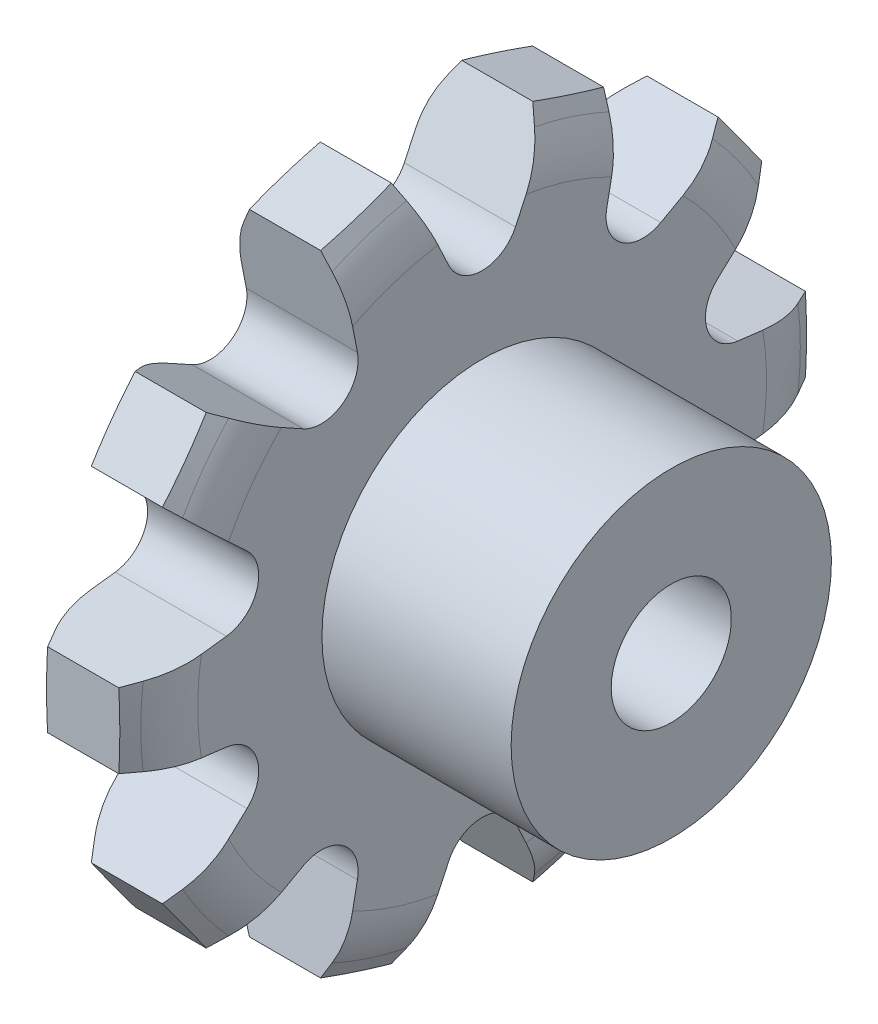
SolidWorks part; units mm, degrees
ref_plane "Plan de face" through (0, 0, 0) normal (0, 0, 1) x (1, 0, 0)
ref_plane "Plan de dessus" through (0, 0, 0) normal (0, 1, 0) x (1, 0, 0)
ref_plane "Plan de droite" through (0, 0, 0) normal (1, 0, 0) x (0, 0, -1)
sketch "Esquisse1" plane through (0, 0, 0) normal (0, 0, 1) x (1, 0, 0)
  line L0 (0, 28.4053) -> (0, 6)
  line L1 (0, 6) -> (30, 6)
  line L2 (30, 6) -> (30, 16)
  line L4 (11.1, 16) -> (11.1, 28.4053)
  line L5 (9.9469, 32.9416) -> (9.1, 34.5)
  line L6 (9.1, 34.5) -> (2, 34.5)
  line L7 (2, 34.5) -> (1.1531, 32.9416)
  line L8 (30, 0) -> (0, 0) construction
  line L10 (11.1, 16) -> (30, 16)
  arc A0 (11.1, 28.4053) -> (9.9469, 32.9416) centre (1.6, 28.4053) ccw
  arc A1 (1.1531, 32.9416) -> (0, 28.4053) centre (9.5, 28.4053) ccw
revolve "Révolution1" add sketch "Esquisse1" angle 360 about L8
ref_plane "Plan1" through (5.55, 0, 0) normal (1, 0, 0) x (0, 0, -1)
sketch "Esquisse2" plane through (5.55, 0, 0) normal (1, 0, 0) x (0, 0, -1)
  line L0 (-34.299, 3.7184) -> (-34.299, -3.7184)
  line L1 (-34.299, -3.7184) -> (-25.5451, -4.7932)
  line L2 (-23.4838, -11.1372) -> (-29.9341, -17.1522)
  line L3 (-29.9341, -17.1522) -> (-25.5629, -23.1687)
  line L4 (-25.5629, -23.1687) -> (-17.849, -18.8928)
  line L5 (-12.4525, -22.8136) -> (-14.1354, -31.4713)
  line L6 (-14.1354, -31.4713) -> (-7.0626, -33.7694)
  line L7 (-7.0626, -33.7694) -> (-3.3352, -25.776)
  line L8 (3.3352, -25.776) -> (7.0626, -33.7694)
  line L9 (7.0626, -33.7694) -> (14.1354, -31.4713)
  line L10 (14.1354, -31.4713) -> (12.4525, -22.8136)
  line L11 (17.849, -18.8928) -> (25.5629, -23.1687)
  line L12 (25.5629, -23.1687) -> (29.9341, -17.1522)
  line L13 (29.9341, -17.1522) -> (23.4838, -11.1372)
  line L14 (25.5451, -4.7932) -> (34.299, -3.7184)
  line L15 (34.299, -3.7184) -> (34.299, 3.7184)
  line L16 (34.299, 3.7184) -> (25.5451, 4.7932)
  line L17 (23.4838, 11.1372) -> (29.9341, 17.1522)
  line L18 (29.9341, 17.1522) -> (25.5629, 23.1687)
  line L19 (25.5629, 23.1687) -> (17.849, 18.8928)
  line L20 (12.4525, 22.8136) -> (14.1354, 31.4713)
  line L21 (14.1354, 31.4713) -> (7.0626, 33.7694)
  line L22 (7.0626, 33.7694) -> (3.3352, 25.776)
  line L23 (-3.3352, 25.776) -> (-7.0626, 33.7694)
  line L24 (-7.0626, 33.7694) -> (-14.1354, 31.4713)
  line L25 (-14.1354, 31.4713) -> (-12.4525, 22.8136)
  line L26 (-17.849, 18.8928) -> (-25.5629, 23.1687)
  line L27 (-25.5629, 23.1687) -> (-29.9341, 17.1522)
  line L28 (-29.9341, 17.1522) -> (-23.4838, 11.1372)
  line L29 (-25.5451, 4.7932) -> (-34.299, 3.7184)
  circle A0 centre (0, 0) radius 51.75
  arc A1 (-25.5451, -4.7932) -> (-23.4838, -11.1372) centre (-25.9935, -8.4458) cw
  arc A2 (-17.849, -18.8928) -> (-12.4525, -22.8136) centre (-16.0649, -22.1114) cw
  arc A3 (-3.3352, -25.776) -> (3.3352, -25.776) centre (0, -27.3312) cw
  arc A4 (12.4525, -22.8136) -> (17.849, -18.8928) centre (16.0649, -22.1114) cw
  arc A5 (23.4838, -11.1372) -> (25.5451, -4.7932) centre (25.9935, -8.4458) cw
  arc A6 (25.5451, 4.7932) -> (23.4838, 11.1372) centre (25.9935, 8.4458) cw
  arc A7 (17.849, 18.8928) -> (12.4525, 22.8136) centre (16.0649, 22.1114) cw
  arc A8 (3.3352, 25.776) -> (-3.3352, 25.776) centre (0, 27.3312) cw
  arc A9 (-12.4525, 22.8136) -> (-17.849, 18.8928) centre (-16.0649, 22.1114) cw
  arc A10 (-23.4838, 11.1372) -> (-25.5451, 4.7932) centre (-25.9935, 8.4458) cw
extrude "Enlèv. mat.-Extru.1" cut sketch "Esquisse2" along normal blind 11.1 and the other way blind 11.1
ref_plane "Plan2" through (0, 0, 0) normal (0, 0, 1) x (1, 0, 0)
ref_plane "Plan3" through (0, 0, 0) normal (0, 1, 0) x (-1, 0, 0)
